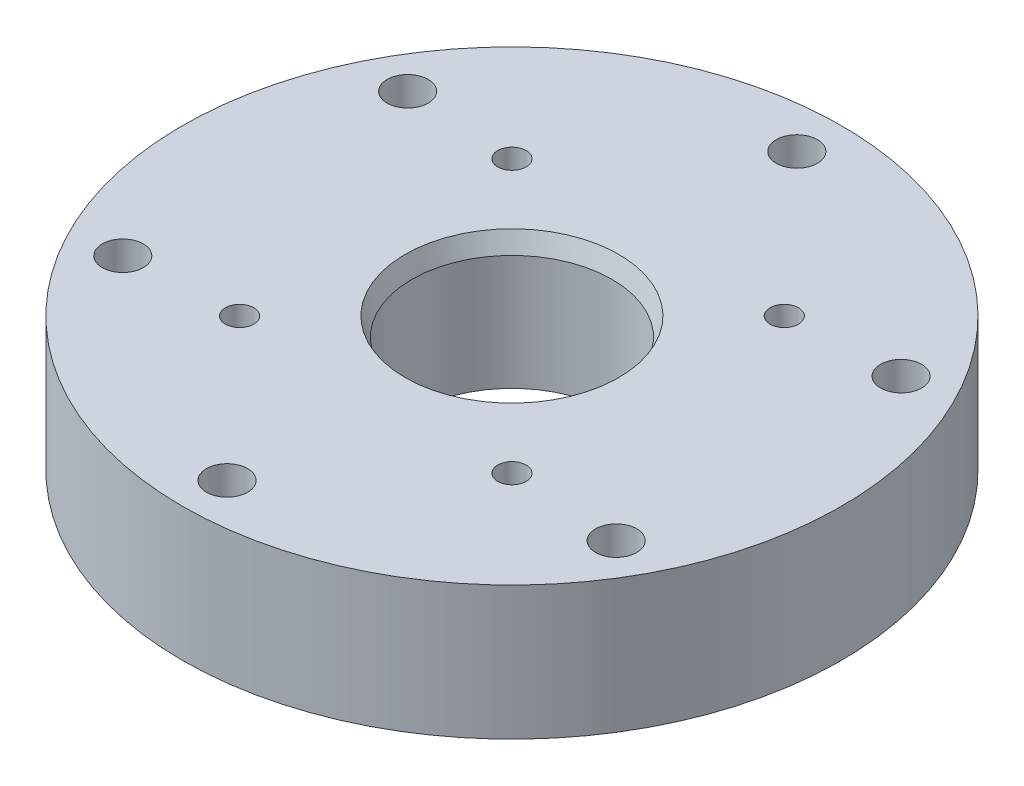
SolidWorks part; units mm, degrees
ref_plane "FRONT" through (0, 0, 0) normal (0, 0, 1) x (1, 0, 0)
ref_plane "TOP" through (0, 0, 0) normal (0, 1, 0) x (1, 0, 0)
ref_plane "RIGHT" through (0, 0, 0) normal (1, 0, 0) x (0, 0, -1)
sketch "Sketch2" plane through (0, 0, 0) normal (0, 0, 1) x (1, 0, 0)
  line L0 (9.525, 0) -> (9.525, 10.9554)
  line L1 (9.525, 10.9554) -> (10.16, 12.7)
  line L2 (10.16, 12.7) -> (31.3531, 12.7)
  line L3 (31.3531, 12.7) -> (31.3531, 0)
  line L4 (31.3531, 0) -> (9.525, 0)
  line L5 (0, 61.0124) -> (0, -54.2041) construction
  line L6 (31.3531, -47.625) -> (31.3531, 0) construction
  dimension "D1" = 12.7
  dimension "D2" = 9.525
  dimension "D3" = 250
  dimension "D4" = 10.16
revolve "Base-Revolve" add sketch "Sketch2" angle 360 about L5
hole_wizard "#6-32 Tapped Hole1" positions "Sketch5" profile "Sketch4"
sketch "Sketch5" plane through (0, 12.7, 0) normal (0, 1, 0) x (-1, 0, 0)
  circle A0 centre (12.954, 12.954) radius 1.9558 construction
  point P0 (12.954, 12.954)
sketch "Sketch4" plane through (-12.954, 12.7, 12.954) normal (1, 0, 0) x (0, 0, 1)
  line L0 (0, 0) -> (0, 11.7855)
  line L1 (0, 11.7855) -> (1.3525, 10.9728)
  line L2 (1.3525, 10.9728) -> (1.3525, 0.0025)
  line L3 (1.3525, 0.0025) -> (1.3525, 0)
  line L5 (1.3525, 0) -> (0, 0)
  line L6 (-1.3525, 0.0025) -> (-1.3525, 0) construction
  line L10 (0, 11.7855) -> (-1.3525, 10.9728) construction
  line L11 (0, -6.35) -> (0, 107.95) construction
pattern_circular "CirPattern1" [suppressed] count 4 every 90 about axis through (0, 61.0124, 0) along (0, -1, 0)
sketch "Sketch6" plane through (0, 12.7, 0) normal (0, 1, 0) x (-1, 0, 0)
  circle A0 centre (23.4708, 13.5509) radius 1.9558
  dimension "D1" = 3.9116
extrude "Cut-Extrude1" cut sketch "Sketch6" against normal through all
pattern_circular "CirPattern2" count 6 every 60 about axis through (0, 0, 0) along (0, 1, 0) of "Cut-Extrude1"
hole_wizard "#6-32 Tapped Hole2" positions "Sketch8" profile "Sketch7" legacy
sketch "Sketch8" plane through (0, 12.7, 0) normal (0, 1, 0) x (-1, 0, 0)
  point P0 (12.954, 12.954)
  dimension "D1" = 12.954
  dimension "D2" = 12.954
sketch "Sketch7" plane through (-12.954, 12.7, 12.954) normal (1, 0, 0) x (0, 0, 1)
  line L0 (0, 0) -> (0, 10.3377)
  line L1 (0, 10.3377) -> (1.3525, 9.525)
  line L2 (1.3525, 9.525) -> (1.3525, 0.0025)
  line L3 (1.3525, 0.0025) -> (1.3525, 0)
  line L5 (1.3525, 0) -> (0, 0)
  line L6 (-1.3525, 0.0025) -> (-1.3525, 0) construction
  line L10 (0, 10.3377) -> (-1.3525, 9.525) construction
  line L11 (0, -6.35) -> (0, 107.95) construction
pattern_linear "LPattern3" count 2 spacing 25.908 along (1, 0, 0) count 2 spacing 25.908 along (0, 0, -1) of "#6-32 Tapped Hole2"
